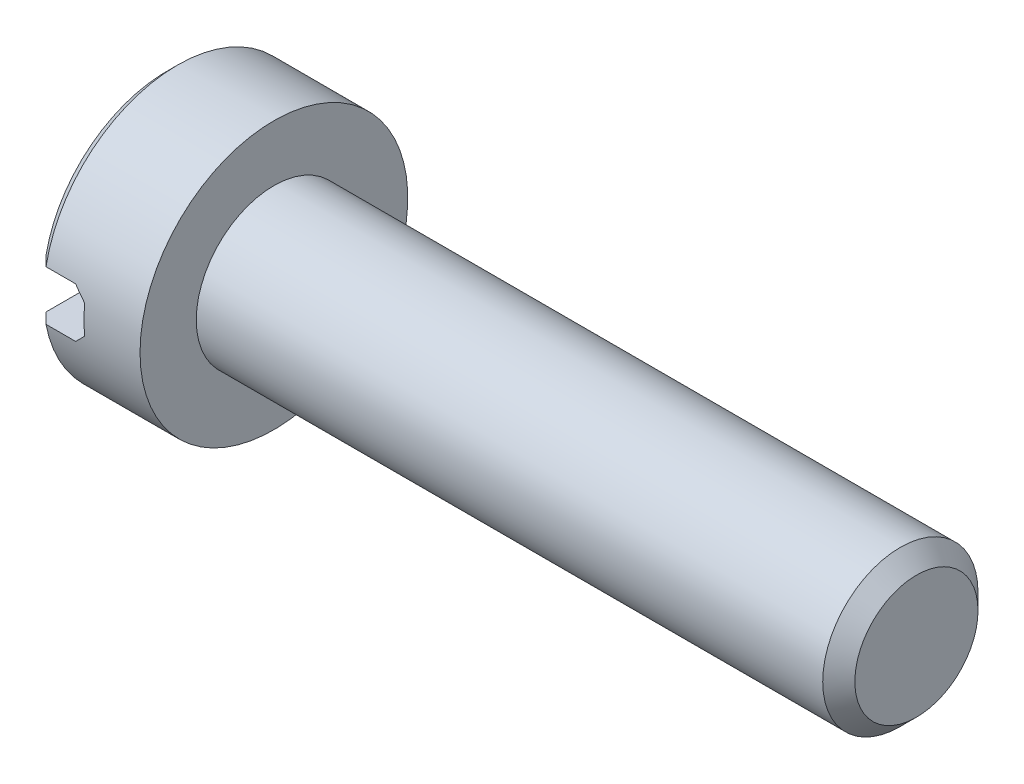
SolidWorks part; units mm, degrees
ref_plane "Face" through (0, 0, 0) normal (0, 0, 1) x (1, 0, 0)
ref_plane "Dessus" through (0, 0, 0) normal (0, 1, 0) x (1, 0, 0)
ref_plane "Droite" through (0, 0, 0) normal (1, 0, 0) x (0, 0, -1)
sketch "Esquisse1" plane through (0, 0, 0) normal (0, 0, 1) x (1, 0, 0)
  line L0 (0, 0) -> (0, 2.3)
  line L1 (0.2, 2.5) -> (2, 2.5)
  line L2 (2, 2.5) -> (2, 0)
  line L5 (0, 0) -> (7.6423, 0) construction
  line L7 (0, 2.3) -> (0.2, 2.5)
  line L8 (0, 0) -> (2, 0)
  point P1 (0, 2.5)
  dimension "D1" = 2.5
  dimension "D3" = 2
revolve "Révolution1" add sketch "Esquisse1" angle 360 about L5
sketch "Esquisse2" plane through (0, 0, 0) normal (0, 0, 1) x (1, 0, 0)
  line L0 (0, 2.3) -> (0, -2.3) construction
  line L1 (0, 0.4655) -> (0.7534, 0.4655)
  line L2 (0, 0.4655) -> (0, -0.4655)
  line L3 (0, -0.4655) -> (0.7534, -0.4655)
  line L4 (0.9534, 0.2655) -> (0.9534, -0.2655)
  line L5 (0.7534, 0.4655) -> (0.9534, 0.2655)
  line L6 (0.7534, -0.4655) -> (0.9534, -0.2655)
  point P1 (0.9534, -0.4655)
  point P3 (0.9534, 0.4655)
extrude "Enlèv. mat.-Extru.1" cut sketch "Esquisse2" against normal mid plane 10
sketch "Esquisse3" plane through (2, 0, 0) normal (1, 0, 0) x (0, 0, -1)
  circle A0 centre (0, 0) radius 1.45
extrude "Extrusion1" add sketch "Esquisse3" along normal blind 12
chamfer "Chanfrein1" distance 0.3 angle 45 1 edges at (14, 0, -1.45)
